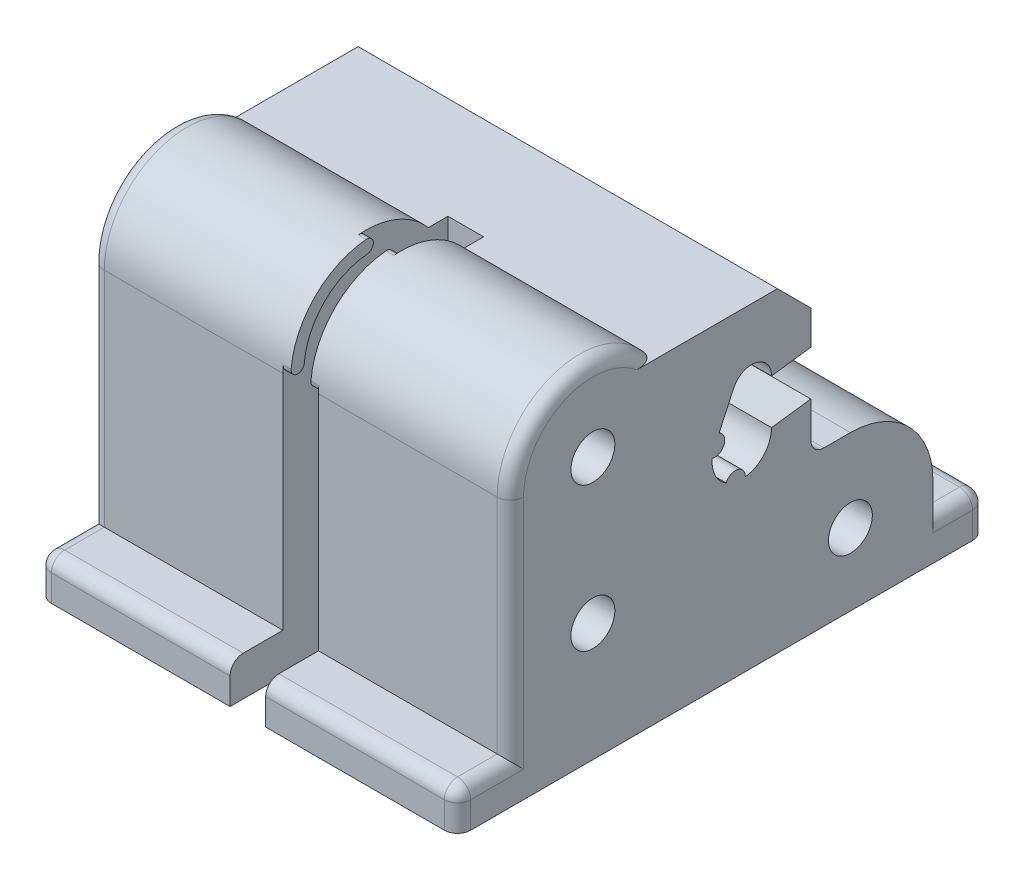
SolidWorks part; units mm, degrees
other "<finger_flexure_print>-<Pulley Cover Fillet>"
ref_plane "Front Plane" through (0, 0, 0) normal (0, 0, 1) x (1, 0, 0)
ref_plane "Top Plane" through (0, 0, 0) normal (0, 1, 0) x (1, 0, 0)
ref_plane "Right Plane" through (0, 0, 0) normal (1, 0, 0) x (0, 0, -1)
inserted part "finger_flexure_print"
sketch "Sketch1" plane through (15.875, 0, 0) normal (1, 0, 0) x (0, 0, -1)
  line L1 (11.375, 2.4005) -> (11.375, -2.4005)
  line L4 (27.7307, 12.0784) -> (63.0336, 21.5378)
  line L8 (115.3247, 43.1358) -> (116.3122, 42.9188)
  line L10 (-14.375, -14.1005) -> (-11.375, -14.1005) construction
  line L11 (-11.375, 2.75) -> (-10.375, 2.75)
  line L12 (-1.7843, 6.8) -> (-0.3647, 6.8)
  line L15 (-15.375, -17.1005) -> (-15.375, -15.1005) construction
  line L16 (-15.375, -17.1005) -> (-14.375, -17.1005) construction
  line L17 (-14.375, -14.1005) -> (-11.375, -14.1005)
  line L18 (-11.375, -14.1005) -> (-10.375, -15.1005)
  line L19 (-10.375, -15.1005) -> (-10.375, 2.75)
  line L20 (-10.375, 2.75) -> (-11.375, 2.75)
  line L21 (-11.375, 2.75) -> (-11.375, -14.1005)
  line L25 (-11.375, 2.75) -> (-11.375, -14.1005)
  line L26 (-15.375, -17.1005) -> (-15.375, -15.1005)
  line L27 (-15.375, -17.1005) -> (-14.375, -17.1005)
  line L28 (20.625, -14.1005) -> (23.625, -14.1005) construction
  line L29 (24.625, -15.1005) -> (24.625, -17.1005) construction
  line L30 (23.625, -17.1005) -> (24.625, -17.1005) construction
  line L31 (20.625, -14.1005) -> (23.625, -14.1005)
  line L32 (24.625, -15.1005) -> (24.625, -17.1005)
  line L33 (23.625, -17.1005) -> (24.625, -17.1005)
  line L41 (-14.375, -17.1005) -> (23.625, -17.1005)
  line L42 (23.625, -17.1005) -> (23.625, -15.1005)
  line L43 (23.625, -15.1005) -> (20.625, -15.1005)
  line L44 (20.625, -15.1005) -> (20.625, -11.6505)
  line L45 (14.375, -5.4005) -> (12.375, -5.4005)
  line L46 (11.375, -4.4005) -> (11.375, -2.4005)
  line L47 (11.375, -2.4005) -> (23.8936, -0.7524)
  line L48 (23.8936, -0.7524) -> (26.5211, -3.8884)
  line L49 (31.6478, -5.507) -> (31.8116, -5.4631)
  line L50 (34.8476, -3.1335) -> (38.8636, 3.8225)
  line L51 (41.8997, 6.1521) -> (53.7261, 9.321)
  line L52 (57.5202, 8.8215) -> (64.4762, 4.8055)
  line L53 (68.2703, 4.306) -> (69.0649, 4.5189)
  line L54 (72.7614, 9.0414) -> (72.9287, 11.7598)
  line L55 (72.9287, 11.7598) -> (84.81, 16.6812)
  line L56 (84.81, 16.6812) -> (86.8789, 14.9378)
  line L57 (92.7076, 14.4944) -> (93.4693, 14.9598)
  line L58 (95.7229, 18.0527) -> (97.5841, 25.7589)
  line L59 (99.8376, 28.8518) -> (113.4109, 37.1441)
  line L60 (115.6645, 40.237) -> (116.3122, 42.9188)
  line L61 (103.94, 45.9069) -> (83.2549, 33.2698)
  line L62 (82.2755, 29.2145) -> (80.3127, 28.0154)
  line L63 (80.3127, 28.0154) -> (79.6251, 25.1682)
  line L64 (79.6251, 25.1682) -> (81.6646, 21.8297)
  line L65 (81.6646, 21.8297) -> (71.3728, 17.5667)
  line L66 (71.3728, 17.5667) -> (71.0449, 18.7904)
  line L67 (71.0449, 18.7904) -> (65.2552, 22.1331)
  line L68 (65.2552, 22.1331) -> (63.0336, 21.5378)
  line L69 (59.4206, 23.6238) -> (29.8167, 15.6914)
  line L70 (27.7307, 12.0784) -> (25.5091, 11.4831)
  line L71 (25.5091, 11.4831) -> (22.1665, 5.6935)
  line L72 (22.1665, 5.6935) -> (22.651, 3.8851)
  line L73 (22.651, 3.8851) -> (11.375, 2.4005)
  line L74 (11.375, 2.4005) -> (11.375, 4.2728)
  line L75 (11.375, 4.2728) -> (8.8478, 6.8)
  line L76 (8.8478, 6.8) -> (-1.7843, 6.8)
  line L77 (-10.375, 2.75) -> (-10.375, -15.1005)
  line L78 (-10.375, -15.1005) -> (-14.375, -15.1005)
  line L79 (-14.375, -15.1005) -> (-14.375, -17.1005)
  line L80 (-14.375, -17.1005) -> (23.625, -17.1005)
  line L83 (20.625, -14.1005) -> (20.625, -11.6505)
  line L84 (14.375, -5.4005) -> (12.375, -5.4005)
  line L85 (11.375, -4.4005) -> (11.375, -2.4005)
  line L86 (11.375, -2.4005) -> (23.8936, -0.7524)
  line L87 (23.8936, -0.7524) -> (26.5211, -3.8884)
  line L88 (31.6478, -5.507) -> (31.8116, -5.4631)
  line L89 (34.8476, -3.1335) -> (38.8636, 3.8225)
  line L90 (41.8997, 6.1521) -> (53.7261, 9.321)
  line L91 (57.5202, 8.8215) -> (64.4762, 4.8055)
  line L92 (68.2703, 4.306) -> (69.0649, 4.5189)
  line L93 (72.7614, 9.0414) -> (72.9287, 11.7598)
  line L94 (72.9287, 11.7598) -> (84.81, 16.6812)
  line L95 (84.81, 16.6812) -> (86.8789, 14.9378)
  line L96 (92.7076, 14.4944) -> (93.4693, 14.9598)
  line L97 (95.7229, 18.0527) -> (97.5841, 25.7589)
  line L98 (99.8376, 28.8518) -> (113.4109, 37.1441)
  line L99 (115.6645, 40.237) -> (116.3122, 42.9188)
  line L100 (103.94, 45.9069) -> (83.2549, 33.2698)
  line L101 (82.2755, 29.2145) -> (80.3127, 28.0154)
  line L102 (80.3127, 28.0154) -> (79.6251, 25.1682)
  line L103 (79.6251, 25.1682) -> (81.6646, 21.8297)
  line L104 (81.6646, 21.8297) -> (71.3728, 17.5667)
  line L105 (71.3728, 17.5667) -> (71.0449, 18.7904)
  line L106 (71.0449, 18.7904) -> (65.2552, 22.1331)
  line L107 (65.2552, 22.1331) -> (63.0336, 21.5378)
  line L108 (59.4206, 23.6238) -> (29.8167, 15.6914)
  line L109 (27.7307, 12.0784) -> (25.5091, 11.4831)
  line L110 (25.5091, 11.4831) -> (22.1665, 5.6935)
  line L111 (22.1665, 5.6935) -> (22.651, 3.8851)
  line L112 (22.651, 3.8851) -> (11.375, 2.4005)
  line L113 (11.375, 2.4005) -> (11.375, 4.2728)
  line L114 (11.375, 4.2728) -> (8.8478, 6.8)
  line L115 (8.8478, 6.8) -> (-0.3647, 6.8)
  arc A2 (115.3247, 43.1358) -> (104.305, 45.3096) centre (108.632, 38.2267) ccw construction
  arc A3 (115.3247, 43.1358) -> (110.3269, 46.3519) centre (108.632, 38.2267) ccw
  arc A7 (-14.375, -14.1005) -> (-15.375, -15.1005) centre (-14.375, -15.1005) ccw construction
  arc A8 (-14.375, -14.1005) -> (-15.375, -15.1005) centre (-14.375, -15.1005) ccw
  arc A9 (-1.7843, 6.8) -> (-10.375, 2.75) centre (-5.125, 2.75) ccw
  arc A10 (-0.3647, 6.8) -> (-11.375, 2.75) centre (-5.125, 2.75) ccw
  arc A12 (-0.3647, 6.8) -> (-11.375, 2.75) centre (-5.125, 2.75) ccw
  arc A13 (24.625, -15.1005) -> (23.625, -14.1005) centre (23.625, -15.1005) ccw construction
  arc A14 (24.625, -15.1005) -> (23.625, -14.1005) centre (23.625, -15.1005) ccw
  arc A21 (20.625, -11.6505) -> (14.375, -5.4005) centre (14.375, -11.6505) ccw
  arc A22 (11.375, -4.4005) -> (12.375, -5.4005) centre (12.375, -4.4005) ccw
  arc A23 (26.5211, -3.8884) -> (31.6478, -5.507) centre (30.3537, -0.6773) ccw
  arc A24 (31.8116, -5.4631) -> (34.8476, -3.1335) centre (30.5175, -0.6335) ccw
  arc A25 (41.8997, 6.1521) -> (38.8636, 3.8225) centre (43.1937, 1.3225) ccw
  arc A26 (57.5202, 8.8215) -> (53.7261, 9.321) centre (55.0202, 4.4914) ccw
  arc A27 (64.4762, 4.8055) -> (68.2703, 4.306) centre (66.9762, 9.1356) ccw
  arc A28 (69.0649, 4.5189) -> (72.7614, 9.0414) centre (67.7708, 9.3485) ccw
  arc A29 (86.8789, 14.9378) -> (92.7076, 14.4944) centre (90.1009, 18.7612) ccw
  arc A30 (93.4693, 14.9598) -> (95.7229, 18.0527) centre (90.8626, 19.2265) ccw
  arc A31 (99.8376, 28.8518) -> (97.5841, 25.7589) centre (102.4443, 24.5851) ccw
  arc A32 (113.4109, 37.1441) -> (115.6645, 40.237) centre (110.8043, 41.4109) ccw
  arc A33 (116.3122, 42.9188) -> (103.94, 45.9069) centre (108.632, 38.2267) ccw
  arc A34 (83.2549, 33.2698) -> (82.2755, 29.2145) centre (84.7928, 30.7524) ccw
  arc A35 (63.0336, 21.5378) -> (59.4206, 23.6238) centre (60.1841, 20.7743) ccw
  arc A36 (29.8167, 15.6914) -> (27.7307, 12.0784) centre (30.5802, 12.8419) ccw
  arc A37 (-1.7843, 6.8) -> (-10.375, 2.75) centre (-5.125, 2.75) ccw
  arc A38 (20.625, -11.6505) -> (14.375, -5.4005) centre (14.375, -11.6505) ccw
  arc A39 (11.375, -4.4005) -> (12.375, -5.4005) centre (12.375, -4.4005) ccw
  arc A40 (26.5211, -3.8884) -> (31.6478, -5.507) centre (30.3537, -0.6773) ccw
  arc A41 (31.8116, -5.4631) -> (34.8476, -3.1335) centre (30.5175, -0.6335) ccw
  arc A42 (41.8997, 6.1521) -> (38.8636, 3.8225) centre (43.1937, 1.3225) ccw
  arc A43 (57.5202, 8.8215) -> (53.7261, 9.321) centre (55.0202, 4.4914) ccw
  arc A44 (64.4762, 4.8055) -> (68.2703, 4.306) centre (66.9762, 9.1356) ccw
  arc A45 (69.0649, 4.5189) -> (72.7614, 9.0414) centre (67.7708, 9.3485) ccw
  arc A46 (86.8789, 14.9378) -> (92.7076, 14.4944) centre (90.1009, 18.7612) ccw
  arc A47 (93.4693, 14.9598) -> (95.7229, 18.0527) centre (90.8626, 19.2265) ccw
  arc A48 (99.8376, 28.8518) -> (97.5841, 25.7589) centre (102.4443, 24.5851) ccw
  arc A49 (113.4109, 37.1441) -> (115.6645, 40.237) centre (110.8043, 41.4109) ccw
  arc A50 (116.3122, 42.9188) -> (103.94, 45.9069) centre (108.632, 38.2267) ccw
  arc A51 (83.2549, 33.2698) -> (82.2755, 29.2145) centre (84.7928, 30.7524) ccw
  arc A52 (63.0336, 21.5378) -> (59.4206, 23.6238) centre (60.1841, 20.7743) ccw
  arc A53 (29.8167, 15.6914) -> (27.7307, 12.0784) centre (30.5802, 12.8419) ccw
  dimension "D1" = 0
  dimension "D2" = 0
  dimension "D3" = 0
extrude "Piece Cut" cut sketch "Sketch1" against normal through all
ref_point "Ref Center"
